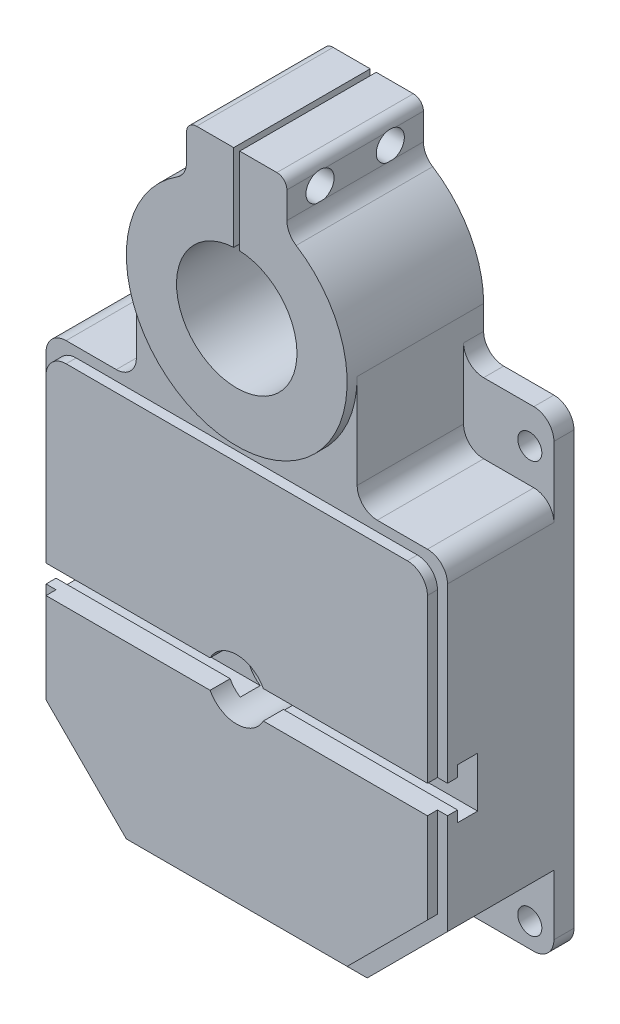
SolidWorks part; units mm, degrees
ref_plane "前视基准面" through (0, 0, 0) normal (0, 0, 1) x (1, 0, 0)
ref_plane "上视基准面" through (0, 0, 0) normal (0, 1, 0) x (1, 0, 0)
ref_plane "右视基准面" through (0, 0, 0) normal (1, 0, 0) x (0, 0, -1)
sketch "草图1" plane through (0, 0, 0) normal (0, 0, 1) x (1, 0, 0)
  line L0 (0, 0) -> (0, 160) construction
  line L1 (0, 160) -> (0, 233) construction
  line L2 (0, 233) -> (20, 233)
  line L3 (0, 233) -> (-20, 233)
  line L4 (-25, 228) -> (-25, 214.7723)
  line L5 (25, 228) -> (25, 214.7723)
  line L6 (0, 0) -> (100, 0) construction
  line L7 (100, 128) -> (100, -87)
  line L8 (90, -97) -> (-90, -97)
  line L9 (-100, -87) -> (-100, 128)
  line L10 (-90, 138) -> (-65, 138)
  line L11 (0, 0) -> (-88, 0) construction
  line L12 (-88, 0) -> (-88, -85) construction
  line L13 (-88, 0) -> (-88, 120) construction
  line L14 (-55, 160) -> (-55, 148)
  line L15 (55, 160) -> (55, 148)
  line L16 (65, 138) -> (90, 138)
  circle A0 centre (0, 0) radius 15
  circle A1 centre (0, 160) radius 30
  arc A2 (-29.6154, 206.3458) -> (-55, 160) centre (0, 160) ccw
  circle A3 centre (-88, -85) radius 6
  circle A4 centre (-88, 120) radius 6
  circle A5 centre (88, -85) radius 6
  circle A6 centre (88, 120) radius 6
  arc A7 (55, 160) -> (29.6154, 206.3458) centre (0, 160) ccw
  arc A8 (25, 214.7723) -> (29.6154, 206.3458) centre (35, 214.7723) ccw
  arc A9 (-29.6154, 206.3458) -> (-25, 214.7723) centre (-35, 214.7723) ccw
  arc A10 (55, 148) -> (65, 138) centre (65, 148) ccw
  arc A11 (-55, 148) -> (-65, 138) centre (-65, 148) cw
  arc A12 (-100, 128) -> (-90, 138) centre (-90, 128) cw
  arc A13 (90, 138) -> (100, 128) centre (90, 128) cw
  arc A14 (100, -87) -> (90, -97) centre (90, -87) cw
  arc A15 (-100, -87) -> (-90, -97) centre (-90, -87) ccw
  arc A16 (20, 233) -> (25, 228) centre (20, 228) cw
  arc A17 (-25, 228) -> (-20, 233) centre (-20, 228) cw
  dimension "D1" = 10
  dimension "D2" = 5
extrude "凸台-拉伸1" add sketch "草图1" along normal blind 10
sketch "草图2" plane through (0, 0, 10) normal (0, 0, 1) x (1, 0, 0)
  line L0 (100, -87) -> (100, 128) construction
  line L1 (-100, 128) -> (-100, -87) construction
  line L2 (-90, -97) -> (90, -97) construction
  line L3 (100, -57) -> (100, 93)
  line L4 (-100, 93) -> (-100, -57)
  line L5 (-60, -97) -> (60, -97)
  line L6 (-100, -57) -> (-60, -97)
  line L7 (60, -97) -> (100, -57)
  line L8 (0, 0) -> (0, 103) construction
  line L9 (-90, 103) -> (-65, 103)
  line L10 (25, 214.7723) -> (25, 228) construction
  line L11 (-25, 228) -> (-25, 214.7723) construction
  line L12 (20, 233) -> (-20, 233) construction
  line L13 (25, 214.7723) -> (25, 228)
  line L14 (-25, 228) -> (-25, 214.7723)
  line L15 (20, 233) -> (-20, 233)
  line L16 (55, 160) -> (55, 113)
  line L17 (-55, 160) -> (-55, 113)
  line L18 (65, 103) -> (90, 103)
  circle A0 centre (0, 0) radius 15 construction
  circle A1 centre (0, 160) radius 30 construction
  circle A2 centre (0, 0) radius 15
  circle A3 centre (0, 160) radius 30
  arc A4 (90, 103) -> (100, 93) centre (90, 93) cw
  arc A5 (-90, 103) -> (-100, 93) centre (-90, 93) ccw
  arc A6 (25, 214.7723) -> (29.6154, 206.3458) centre (35, 214.7723) ccw construction
  arc A7 (25, 228) -> (20, 233) centre (20, 228) ccw construction
  arc A8 (-29.6154, 206.3458) -> (-25, 214.7723) centre (-35, 214.7723) ccw construction
  arc A9 (-20, 233) -> (-25, 228) centre (-20, 228) ccw construction
  arc A10 (25, 214.7723) -> (29.6154, 206.3458) centre (35, 214.7723) ccw
  arc A11 (25, 228) -> (20, 233) centre (20, 228) ccw
  arc A12 (-29.6154, 206.3458) -> (-25, 214.7723) centre (-35, 214.7723) ccw
  arc A13 (-20, 233) -> (-25, 228) centre (-20, 228) ccw
  arc A14 (-29.6154, 206.3458) -> (-55, 160) centre (0, 160) ccw
  arc A15 (55, 160) -> (29.6154, 206.3458) centre (0, 160) ccw
  arc A16 (55, 113) -> (65, 103) centre (65, 113) ccw
  arc A17 (-55, 113) -> (-65, 103) centre (-65, 113) cw
  point P14 (-100, -97)
  point P17 (100, -97)
  dimension "D1" = 10
  dimension "D2" = 10
extrude "凸台-拉伸2" add sketch "草图2" along normal blind 53
sketch "草图3" plane through (0, 0, 63) normal (0, 0, 1) x (1, 0, 0)
  line L0 (0, 0) -> (95, 0) construction
  line L1 (95, 88) -> (95, -52)
  line L2 (55, -92) -> (-55, -92)
  line L3 (-95, -52) -> (-95, 88)
  line L4 (-85, 98) -> (85, 98)
  line L5 (-55, -92) -> (-95, -52)
  line L6 (95, -52) -> (55, -92)
  line L7 (25, 214.7723) -> (25, 228) construction
  line L8 (-25, 228) -> (-25, 214.7723) construction
  line L9 (20, 233) -> (-20, 233) construction
  line L10 (25, 214.7723) -> (25, 228)
  line L11 (-25, 228) -> (-25, 214.7723)
  line L12 (20, 233) -> (-20, 233)
  arc A0 (-85, 98) -> (-95, 88) centre (-85, 88) ccw
  arc A1 (95, 88) -> (85, 98) centre (85, 88) ccw
  arc A2 (25, 214.7723) -> (29.6154, 206.3458) centre (35, 214.7723) ccw construction
  arc A3 (25, 228) -> (20, 233) centre (20, 228) ccw construction
  arc A4 (-29.6154, 206.3458) -> (-25, 214.7723) centre (-35, 214.7723) ccw construction
  arc A5 (-20, 233) -> (-25, 228) centre (-20, 228) ccw construction
  circle A6 centre (0, 160) radius 30 construction
  arc A7 (25, 214.7723) -> (29.6154, 206.3458) centre (35, 214.7723) ccw
  arc A8 (25, 228) -> (20, 233) centre (20, 228) ccw
  arc A9 (-29.6154, 206.3458) -> (-25, 214.7723) centre (-35, 214.7723) ccw
  arc A10 (-20, 233) -> (-25, 228) centre (-20, 228) ccw
  circle A11 centre (0, 160) radius 30
  arc A12 (-29.6154, 206.3458) -> (29.6154, 206.3458) centre (0, 160) ccw
  point P3 (95, -92)
  point P5 (-95, -92)
  dimension "D1" = 10
extrude "凸台-拉伸3" add sketch "草图3" along normal blind 5
sketch "草图4" plane through (0, 0, 0) normal (0, 0, -1) x (-1, 0, 0)
  line L0 (0, 0) -> (90, 0) construction
  line L1 (90, 83) -> (90, -47)
  line L2 (50, -87) -> (-50, -87)
  line L3 (-90, -47) -> (-90, 83)
  line L4 (-80, 93) -> (-50, 93)
  line L5 (-50, -87) -> (-90, -47)
  line L6 (90, -47) -> (50, -87)
  line L7 (0, 93) -> (0, 118) construction
  line L8 (0, 118) -> (30, 118)
  line L9 (0, 118) -> (-30, 118)
  line L10 (-40, 108) -> (-40, 103)
  line L11 (40, 108) -> (40, 103)
  line L12 (50, 93) -> (80, 93)
  arc A0 (80, 93) -> (90, 83) centre (80, 83) cw
  arc A1 (-80, 93) -> (-90, 83) centre (-80, 83) ccw
  arc A2 (30, 118) -> (40, 108) centre (30, 108) cw
  arc A3 (-40, 108) -> (-30, 118) centre (-30, 108) cw
  arc A4 (40, 103) -> (50, 93) centre (50, 103) ccw
  arc A5 (-40, 103) -> (-50, 93) centre (-50, 103) cw
  point P5 (90, -87)
  point P6 (-90, -87)
  dimension "D1" = 10
  dimension "D2" = 10
extrude "切除-拉伸1" cut sketch "草图4" against normal blind 53
sketch "草图5" plane through (0, 0, 63) normal (0, 0, -1) x (-1, 0, 0)
  circle A0 centre (0, 0) radius 15 construction
  circle A1 centre (0, 0) radius 15
extrude "切除-拉伸2" cut sketch "草图5" against normal through all
sketch "草图6" plane through (0, 0, 53) normal (0, 0, -1) x (-1, 0, 0)
  line L1 (90, 22.5) -> (-90, 22.5)
  line L2 (90, 22.5) -> (90, -22.5)
  line L3 (90, -22.5) -> (-90, -22.5)
  line L4 (-90, 22.5) -> (-90, -22.5)
  line L5 (90, 22.5) -> (-90, -22.5) construction
  line L6 (90, -22.5) -> (-90, 22.5) construction
  circle A0 centre (0, 0) radius 15 construction
  circle A1 centre (0, 0) radius 15
  point P0 (0, 0)
  dimension "D1" = 45
  dimension "D2" = 180
extrude "凸台-拉伸4" add sketch "草图6" along normal blind 18
fillet "圆角1" radius 5 4 edges at (-90, 22.5, 44) (-90, -22.5, 44) (90, 22.5, 44) (90, -22.5, 44)
sketch "草图7" plane through (-100, 0, 0) normal (-1, 0, 0) x (0, 0, 1)
  line L0 (0, 0) -> (48, 0) construction
  line L1 (48, 12.5) -> (48, -12.5)
  line L2 (48, -12.5) -> (58, -12.5)
  line L3 (58, -12.5) -> (58, -7)
  line L4 (58, -7) -> (69, -7)
  line L5 (58, 7) -> (69, 7)
  line L6 (58, 12.5) -> (58, 7)
  line L7 (48, 12.5) -> (58, 12.5)
  line L8 (69, 7) -> (69, -7)
extrude "切除-拉伸3" cut sketch "草图7" against normal blind 200
sketch "草图8" plane through (-100, 0, 0) normal (-1, 0, 0) x (0, 0, 1)
  line L0 (0, 128) -> (0, -87) construction
  line L1 (63, 103) -> (10, 103) construction
  circle A0 centre (29, 70) radius 11
  dimension "D1" = 29
  dimension "D2" = 33
extrude "切除-拉伸4" cut sketch "草图8" against normal blind 10
sketch "草图9" plane through (0, 233, 0) normal (0, 1, 0) x (1, 0, 0)
  line L0 (0, 0) -> (0, -68) construction
  line L1 (20, 0) -> (-20, 0) construction
  line L3 (-1.5, -81.7776) -> (1.5, -81.7776)
  line L4 (-1.5, -81.7776) -> (-1.5, 13.7776)
  line L5 (-1.5, 13.7776) -> (1.5, 13.7776)
  line L6 (1.5, -81.7776) -> (1.5, 13.7776)
  line L7 (-1.5, -81.7776) -> (1.5, 13.7776) construction
  line L8 (-1.5, 13.7776) -> (1.5, -81.7776) construction
  point P4 (0, -34)
  dimension "D1" = 3
extrude "切除-拉伸5" cut sketch "草图9" against normal blind 45
sketch "草图10" plane through (25, 0, 0) normal (1, 0, 0) x (0, 0, -1)
  line L0 (-68, 233) -> (0, 233) construction
  line L1 (-68, 214.7723) -> (-68, 228) construction
  line L2 (0, 214.7723) -> (0, 228) construction
  circle A0 centre (-51.5, 221.5) radius 7
  circle A1 centre (-16.5, 221.5) radius 7
  dimension "D1" = 11.5
  dimension "D2" = 11.5
  dimension "D3" = 16.5
  dimension "D4" = 16.5
extrude "切除-拉伸6" cut sketch "草图10" against normal blind 10
sketch "草图11" plane through (15, 0, 0) normal (1, 0, 0) x (0, 0, -1)
  circle A0 centre (-51.5, 221.5) radius 4.5
  circle A1 centre (-16.5, 221.5) radius 4.5
extrude "切除-拉伸8" cut sketch "草图11" against normal blind 45
sketch "草图12" plane through (0, -97, 0) normal (0, -1, 0) x (1, 0, 0)
  line L1 (-90, 0) -> (90, 0) construction
  line L2 (0, 0) -> (0, 51.0852) construction
  circle A0 centre (32, 35.5) radius 10
  circle A1 centre (47, 35.5) radius 2.5
  circle A2 centre (-47, 35.5) radius 2.5
  dimension "D1" = 35.5
  dimension "D2" = 35.5
  dimension "D3" = 35.5
  dimension "D4" = 32
  dimension "D5" = 47
  dimension "D6" = 94
extrude "切除-拉伸9" cut sketch "草图12" against normal blind 10
